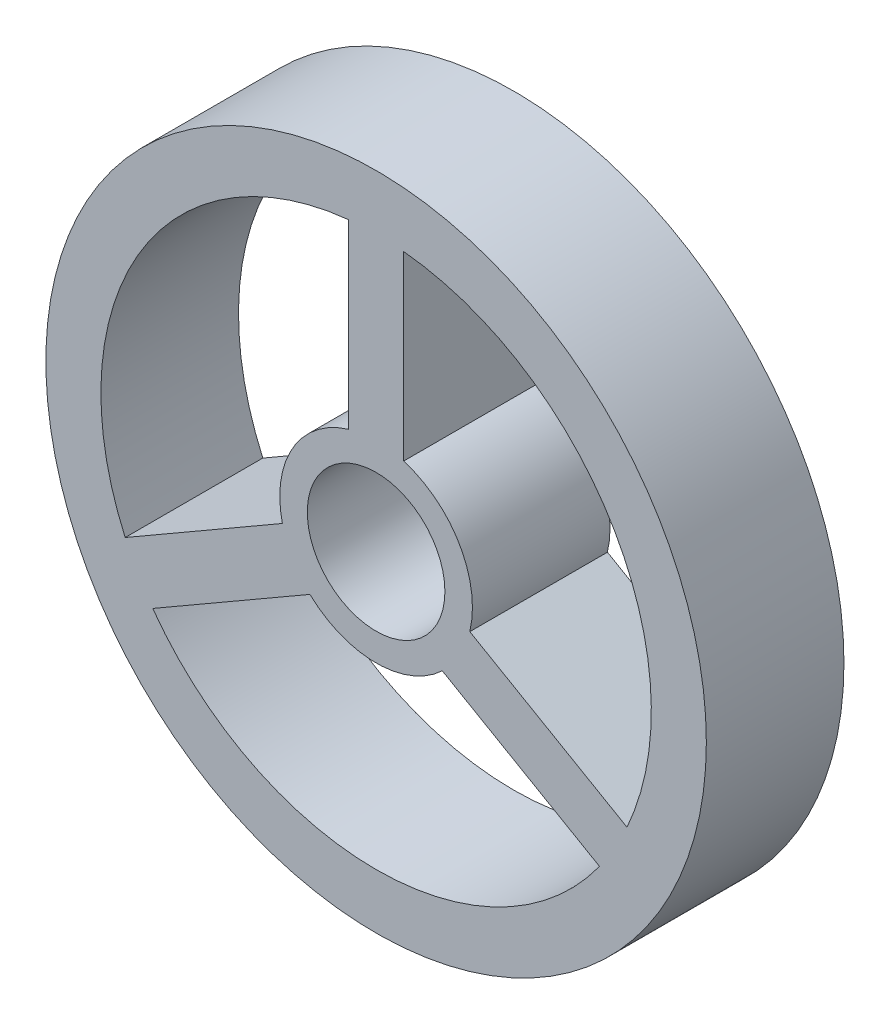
SolidWorks part; units mm, degrees
ref_plane "Ebene vorne" through (0, 0, 0) normal (0, 0, 1) x (1, 0, 0)
ref_plane "Ebene oben" through (0, 0, 0) normal (0, 1, 0) x (1, 0, 0)
ref_plane "Ebene rechts" through (0, 0, 0) normal (1, 0, 0) x (0, 0, -1)
sketch "Skizze1" plane through (0, 0, 0) normal (0, 0, 1) x (1, 0, 0)
  line L0 (0, 12) -> (0, 0) construction
  line L1 (-1, 9.9499) -> (-1, 3.3541)
  line L2 (1, 9.9499) -> (1, 3.3541)
  line L3 (9.1168, -4.1089) -> (3.4047, -0.811)
  line L4 (8.1168, -5.841) -> (2.4047, -2.5431)
  line L5 (-8.1168, -5.841) -> (-2.4047, -2.5431)
  line L6 (-9.1168, -4.1089) -> (-3.4047, -0.811)
  arc A0 (-1, 9.9499) -> (-9.1168, -4.1089) centre (0, 0) ccw
  circle A1 centre (0, 0) radius 12
  circle A2 centre (0, 0) radius 2.5
  arc A3 (-1, 3.3541) -> (-3.4047, -0.811) centre (0, 0) ccw
  arc A4 (-2.4047, -2.5431) -> (2.4047, -2.5431) centre (0, 0) ccw
  circle A5 centre (0, 0) radius 10 construction
  circle A6 centre (0, 0) radius 3.5 construction
  arc A7 (3.4047, -0.811) -> (1, 3.3541) centre (0, 0) ccw
  arc A8 (9.1168, -4.1089) -> (1, 9.9499) centre (0, 0) ccw
  arc A9 (-8.1168, -5.841) -> (8.1168, -5.841) centre (0, 0) ccw
  point P1 (3.5, 0)
  point P13 (9.563, 2.9237)
  dimension "D1" = 20
  dimension "D3" = 5
  dimension "D5" = 1
  dimension "D2" = 2
  dimension "D4" = 1
extrude "Linear austragen1" add sketch "Skizze1" along normal blind 5
